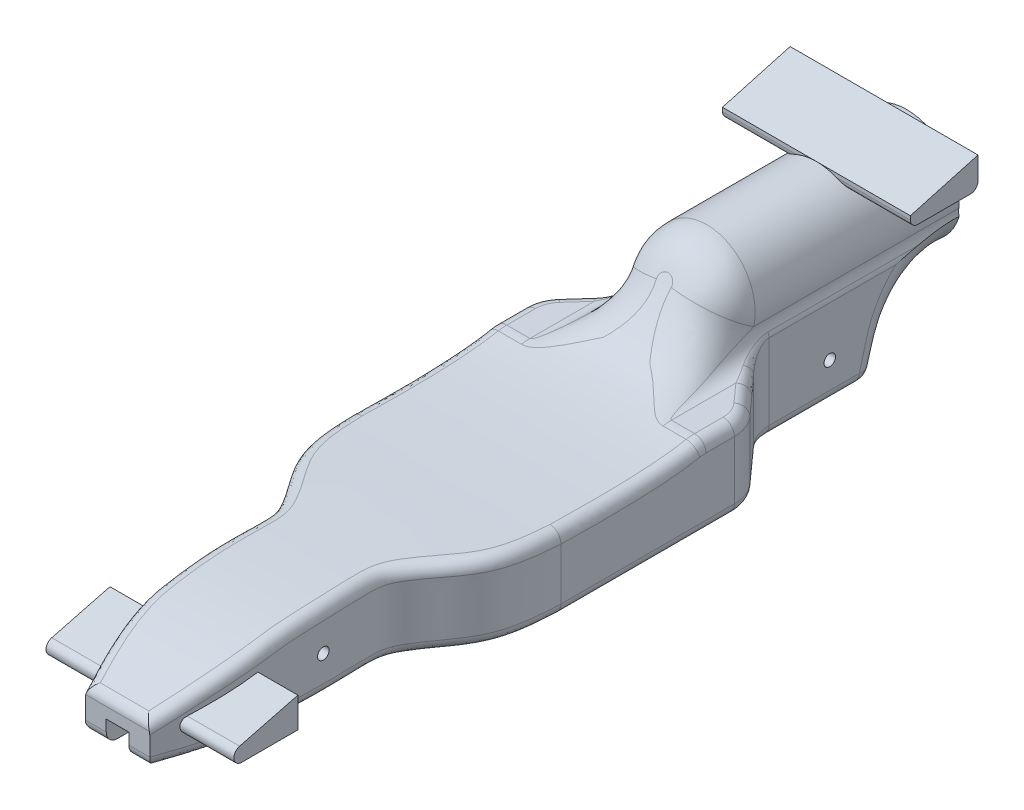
SolidWorks part; units mm, degrees
ref_plane "Front Plane" through (0, 0, 0) normal (0, 0, 1) x (1, 0, 0)
ref_plane "Top Plane" through (0, 0, 0) normal (0, 1, 0) x (1, 0, 0)
ref_plane "Right Plane" through (0, 0, 0) normal (1, 0, 0) x (0, 0, -1)
sketch "Sketch1" plane through (0, 0, 0) normal (0, 0, 1) x (1, 0, 0)
  line L1 (-32.5, 0) -> (32.5, 0)
  line L2 (-32.5, 0) -> (-32.5, 50)
  line L3 (-32.5, 50) -> (32.5, 50)
  line L4 (32.5, 0) -> (32.5, 50)
  dimension "D1" = 65
  dimension "D2" = 50
extrude "Balsa Block" add sketch "Sketch1" along normal blind 223
sketch "Sketch2" plane through (0, 0, 223) normal (0, 0, 1) x (1, 0, 0)
  line L0 (-32.5, 0) -> (32.5, 0) construction
  line L1 (-3, 0) -> (3, 0)
  line L2 (-3, 0) -> (-3, 6)
  line L3 (-3, 6) -> (3, 6)
  line L4 (3, 0) -> (3, 6)
  dimension "D1" = 6
  dimension "D2" = 6
extrude "Screw Eye Slot" cut sketch "Sketch2" against normal through all
sketch "Sketch3" plane through (0, 0, 0) normal (0, 0, -1) x (-1, 0, 0)
  line L0 (32.5, 0) -> (3, 0) construction
  circle A0 centre (0, 29) radius 9.55
  dimension "D1" = 19.1
  dimension "D2" = 29
extrude "CO2 Cartridge Hole" cut sketch "Sketch3" against normal blind 52
sketch "Sketch4" plane through (32.5, 0, 0) normal (1, 0, 0) x (0, 0, -1)
  line L0 (-223, 0) -> (0, 0) construction
  line L1 (0, 0) -> (0, 50) construction
  circle A0 centre (-170, 10) radius 1.525
  circle A1 centre (-35, 10) radius 1.525
  dimension "D4" = 3.05
  dimension "D1" = 10
  dimension "D2" = 135
  dimension "D3" = 35
extrude "Axle Hole Cut Out" cut sketch "Sketch4" against normal through all
sketch "Sketch5" plane through (0, 50, 0) normal (0, 1, 0) x (1, 0, 0)
  line L0 (32.5, 0) -> (-32.5, 0) construction
  line L1 (0, 0) -> (0, -229.7898) construction
  line L2 (-14.55, 0) -> (-14.55, -51.1732)
  line L3 (-17.1047, -57.8491) -> (-25.4453, -67.1509)
  line L4 (-28, -73.8268) -> (-28, -120)
  line L5 (-14.4879, 48.8908) -> (-14.4879, 49.7327) construction
  line L6 (28, -73.8268) -> (28, -120)
  line L7 (17.1047, -57.8491) -> (25.4453, -67.1509)
  line L8 (14.55, 0) -> (14.55, -51.1732)
  line L9 (-14.7766, 49.831) -> (-14.7766, 50.2789) construction
  line L10 (-9.55, 0) -> (-9.55, -52) construction
  line L11 (9.55, -52) -> (9.55, 0) construction
  arc A0 (-25.4453, -67.1509) -> (-28, -73.8268) centre (-18, -73.8268) ccw
  arc A1 (-14.55, -51.1732) -> (-17.1047, -57.8491) centre (-24.55, -51.1732) cw
  arc A2 (14.55, -51.1732) -> (17.1047, -57.8491) centre (24.55, -51.1732) ccw
  arc A3 (25.4453, -67.1509) -> (28, -73.8268) centre (18, -73.8268) cw
  spline S0 degree 3 poles (-28, -120) (-27.6859, -126.0056) (-27.1636, -135.9946) (-19.7034, -144.9636) (-13.3488, -154.8578) (-14.7766, -154.2092) (-14.7766, -173.3072) (-14.4879, -181.2754) (-14.4879, -195.7718) (-8.4397, -210.8954) (-2.3915, -226.019) knots 0 0 0 0 0.179945 0.299298 0.299298 0.625194 0.625194 0.690626 0.690626 1 1 1 1
  spline S1 degree 3 poles (28, -120) (27.6859, -126.0056) (27.1636, -135.9946) (19.7034, -144.9636) (13.3488, -154.8578) (14.7766, -154.2092) (14.7766, -173.3072) (14.4879, -181.2754) (14.4879, -195.7718) (8.4397, -210.8954) (2.3915, -226.019) knots 0 0 0 0 0.179945 0.299298 0.299298 0.625194 0.625194 0.690626 0.690626 1 1 1 1
  spline S2 degree 3 poles (-14.55, 0) (-14.55, -18.3333) (-14.55, -36.6667) (-14.55, -55) knots 0 0 0 0 1 1 1 1
  spline S3 degree 3 poles (14.55, 0) (14.55, -18.3333) (14.55, -36.6667) (14.55, -55) knots 0 0 0 0 1 1 1 1
  dimension "D2" = 5
  dimension "D1" = 5
sketch "Sketch6" plane through (0, 0, 0) normal (1, 0, 0) x (0, 0, -1)
  line L1 (-52, 19.45) -> (0, 19.45) construction
  line L3 (0, 27.5) -> (0, -27.5) construction
  line L10 (-210, 10.9116) -> (-210, 0)
  line L13 (-210, 0) -> (-22.7709, 0)
  spline S0 degree 3 poles (-210, 10.9116) (-202.7227, 13.8598) (-188.783, 19.5071) (-143.7313, 22.444) (-85.5632, 16.1988) (-63.4626, 33.1745) (-61.6089, 55.2214) (-24.8176, 48.2515) (0, 43.55) knots 0 0 0 0 0.060945 0.11674 0.333018 0.333018 0.550088 1 1 1 1
  spline S1 degree 3 poles (-22.7709, 0) (-21.942, 3.2613) (-20.3664, 9.4604) (-11.2641, 16.1435) (-4.1106, 15.068) (0, 14.45) knots 0 0 0 0 0.32075 0.609686 1 1 1 1
  dimension "D3" = 5
  dimension "D1" = 210
  dimension "D2" = 5
sketch "Sketch7" plane through (0, 0, 0) normal (0, 0, -1) x (-1, 0, 0)
  line L0 (18.8348, 21.5) -> (32.5, 21.5)
  line L2 (-18.8348, 21.5) -> (-32.5, 21.5)
  line L5 (0, 0) -> (0, 64.6236) construction
  arc A0 (13.8783, 27.1579) -> (-13.8783, 27.1579) centre (0, 29) ccw
  arc A1 (-13.8783, 27.1579) -> (-18.8348, 21.5) centre (-18.8348, 26.5) cw
  arc A2 (13.8783, 27.1579) -> (18.8348, 21.5) centre (18.8348, 26.5) ccw
  dimension "D1" = 14
  dimension "D3" = 5
  dimension "D2" = 21.5
  dimension "D4" = 65
sketch "Sketch8" plane through (0, 0, 0) normal (1, 0, 0) x (0, 0, -1)
  line L0 (-202.5076, 10) -> (-187, 14)
  line L1 (-187, 14) -> (-187, 6)
  line L2 (-187, 6) -> (-202, 6)
  line L3 (-210, 0) -> (-22.7709, 0) construction
  line L6 (-210, 10.9116) -> (-210, 0) construction
  arc A0 (-202.5076, 10) -> (-202, 6) centre (-202, 8.0322) ccw
  dimension "D1" = 15
  dimension "D2" = 6
  dimension "D3" = 8
  dimension "D4" = 10
  dimension "D5" = 8
extrude "Cut-Extrude1" cut sketch "Sketch5" against normal through all contours S0 L4 A0 L3 A1 L2 M33 M34 M35 | L6 S1 L8 A2 L7 A3 M35 M36 M33
extrude "Cut-Extrude2" cut sketch "Sketch6" against normal through all and the other way through all flip side to cut
extrude "Cut-Extrude3" cut sketch "Sketch7" against normal through all and the other way through all flip side to cut
extrude "Boss-Extrude1" add sketch "Sketch8" along normal mid plane 50
sketch "Sketch9" plane through (0, 0, 0) normal (1, 0, 0) x (0, 0, -1)
  line L0 (-24, 43) -> (-6, 48)
  line L1 (0, 43) -> (-59.8515, 43) construction
  line L2 (-6, 48) -> (-6, 42)
  line L3 (-8, 40) -> (-22, 40)
  line L4 (-24, 42) -> (-24, 43)
  line L5 (0, 27.1579) -> (0, 43) construction
  arc A0 (-6, 42) -> (-8, 40) centre (-8, 42) cw
  arc A1 (-22, 40) -> (-24, 42) centre (-22, 42) cw
  dimension "D1" = 2
  dimension "D2" = 3
  dimension "D3" = 8
  dimension "D4" = 18
  dimension "D5" = 6
extrude "Boss-Extrude2" add sketch "Sketch9" along normal mid plane 50
fillet "Fillet1" radius 3 31 edges at (14.55, 0, 36.9721) (15.2105, 0, 54.7472) (21.275, 0, 62.5) (27.3395, 0, 70.2528) (28, 0, 96.9134) (5.7908, 0, 210) (-5.7908, 0, 210) (-28, 0, 96.9134) (-27.3395, 0, 70.2528) (-21.275, 0, 62.5) (-15.2105, 0, 54.7472) (-14.55, 0, 36.9721) (-14.55, 23.9231, 25.5866) (-14.7762, 23.5797, 53.2883) (-17.9561, 21.5778, 58.7986) (-22.14, 21.5, 63.4647) (-27.3395, 21.5, 70.2528) (-28, 21.5, 78.2147) (-15.33, 20.6441, 152.4527) (0, 10.9116, 210) (14.55, 23.9231, 25.5866) (14.7762, 23.5797, 53.2883) (17.9561, 21.5778, 58.7986) (22.14, 21.5, 63.4647) (27.3395, 21.5, 70.2528) (28, 21.5, 78.2147) (15.33, 20.6441, 152.4527)
fillet "Fillet2" radius 12 7 edges at (-26.8663, 20.8488, 82.5337) (26.8663, 20.8488, 82.5337) (21.9174, 21.5, 82.6025) (17.1807, 21.7815, 81.3793) (-21.9174, 21.5, 82.6025) (-17.3362, 21.7299, 81.5913) (0.0541, 42.9999, 59.8516)
fillet "VarFillet1" radius 15 2 edges
